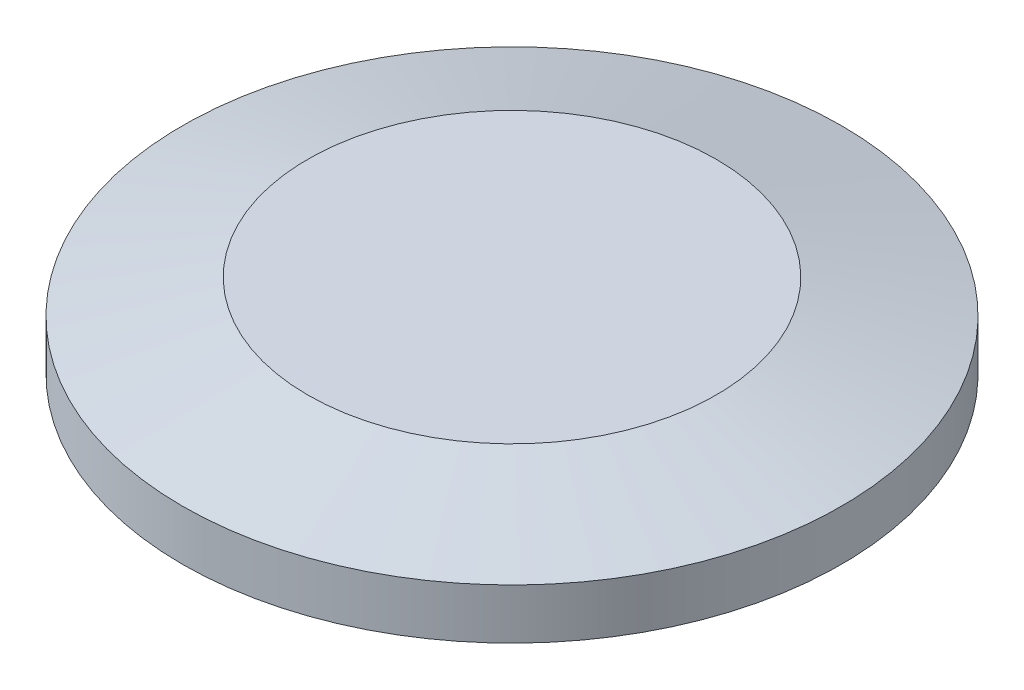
SolidWorks part; units mm, degrees
ref_plane "Front Plane" through (0, 0, 0) normal (0, 0, 1) x (1, 0, 0)
ref_plane "Top Plane" through (0, 0, 0) normal (0, 1, 0) x (1, 0, 0)
ref_plane "Right Plane" through (0, 0, 0) normal (1, 0, 0) x (0, 0, -1)
sketch "Sketch1" plane through (0, 0, 0) normal (1, 0, 0) x (0, 0, -1)
  line L0 (0, 0) -> (0, -95.131) construction
  line L1 (0, 0) -> (19.939, 0)
  line L2 (19.939, 0) -> (19.939, 3.048)
  line L3 (19.939, 3.048) -> (12.3555, 5.08)
  line L4 (12.3555, 5.08) -> (0, 5.08)
  line L5 (0, 5.08) -> (0, 0)
  dimension "D1" = 19.939
  dimension "D2" = 3.048
  dimension "D3" = 5.08
  dimension "D4" = 15
revolve "Revolve1" add sketch "Sketch1" angle 360 about L0
sketch "Sketch2" plane through (0, 0, 0) normal (0, -1, 0) x (1, 0, 0)
  circle A0 centre (0, 0) radius 13.208
  circle A1 centre (0, 0) radius 10.033
  dimension "D1" = 20.066
  dimension "D2" = 26.416
extrude "Cut-Extrude1" cut sketch "Sketch2" against normal blind 1.524
